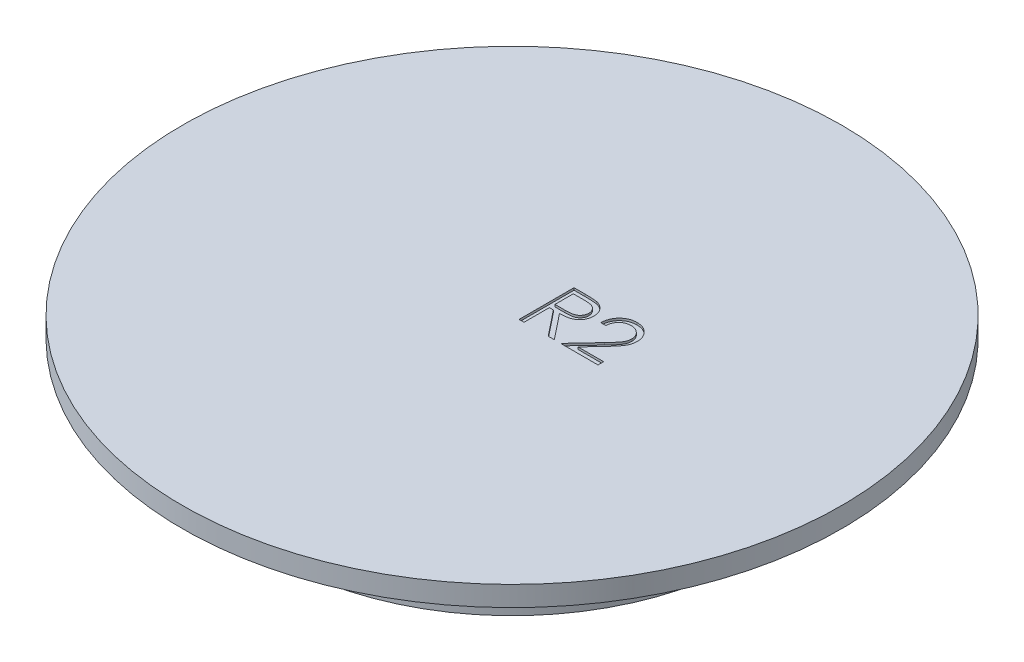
SolidWorks part; units mm, degrees
ref_plane "Front Plane" through (0, 0, 0) normal (0, 0, 1) x (1, 0, 0)
ref_plane "Top Plane" through (0, 0, 0) normal (0, 1, 0) x (1, 0, 0)
ref_plane "Right Plane" through (0, 0, 0) normal (1, 0, 0) x (0, 0, -1)
sketch "Sketch1" plane through (0, 0, 0) normal (0, 1, 0) x (1, 0, 0)
  circle A0 centre (0, 0) radius 54.737
  dimension "D1" = 109.474
extrude "Boss-Extrude1" add sketch "Sketch1" along normal blind 30.48
other "Cavity1"
other "FAN grommet 2<1>@Vent fan mold1"
sketch "Sketch2" plane through (0, 0, 0) normal (0, 0, 1) x (1, 0, 0)
  line L0 (54.737, 23.2904) -> (60.325, 23.2904)
  line L1 (78.74, 23.2904) -> (-78.74, 23.2904) construction
  line L2 (54.737, 9.0313) -> (54.737, 30.48) construction
  line L3 (60.325, 23.2904) -> (60.325, 25.8304)
  line L4 (60.325, 25.8304) -> (76.2, 25.8304)
  line L5 (76.2, 25.8304) -> (76.2, 30.48)
  line L6 (76.2, 30.48) -> (54.737, 30.48)
  line L7 (54.737, 30.48) -> (-54.737, 30.48) construction
  line L9 (0, 0) -> (0, 64.3046) construction
  line L10 (54.737, 23.2904) -> (54.737, 30.48)
  dimension "D1" = 152.4
  dimension "D2" = 2.54
  dimension "D3" = 120.65
revolve "Revolve1" add sketch "Sketch2" angle 360 about L9
sketch "Sketch3" plane through (0, 0, 0) normal (0, -1, 0) x (1, 0, 0)
  circle A0 centre (0, 0) radius 19.05
  dimension "D1" = 38.1
extrude "Boss-Extrude2" add sketch "Sketch3" along normal blind 9.525
draft "Draft1" type of draft neutral plane draft angle 2 faces to draft 1 parameters "D1"=2
sketch "Sketch4" plane through (0, 30.48, 0) normal (0, 1, 0) x (1, 0, 0)
  text T0 "R2 " font "Century Gothic" height in points 48
extrude "Cut-Extrude1" cut sketch "Sketch4" against normal blind 0.508
